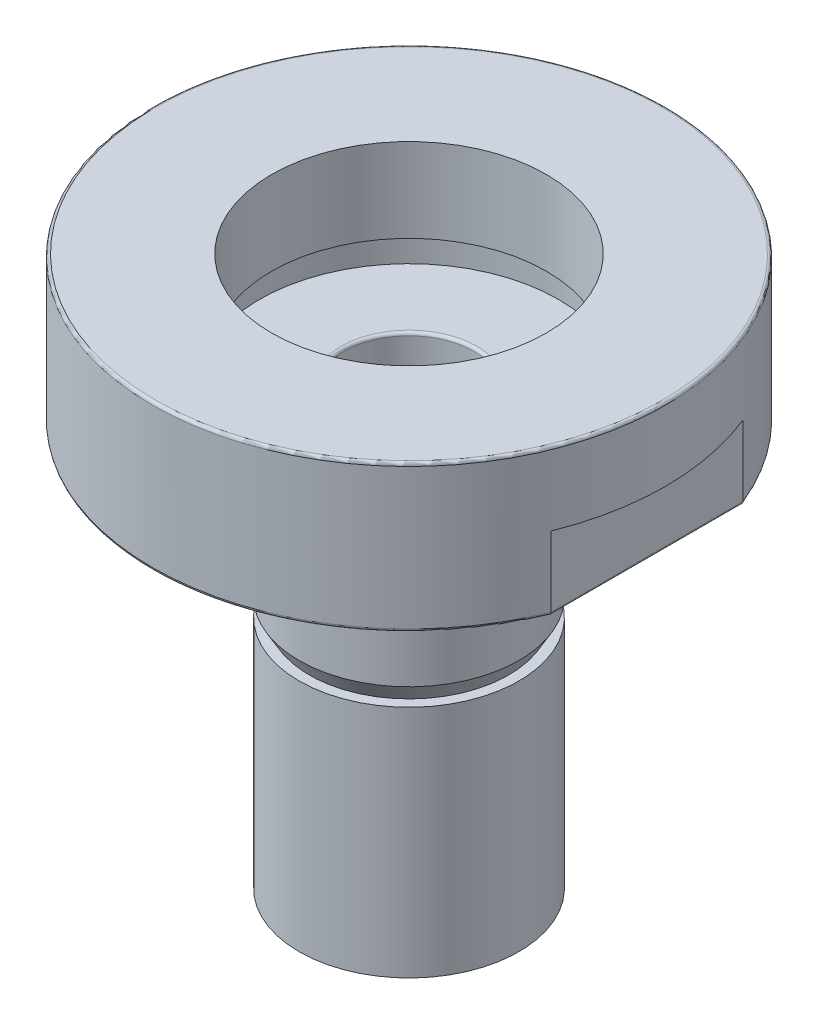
SolidWorks part; units mm, degrees
ref_plane "Front Plane" through (0, 0, 0) normal (0, 0, 1) x (1, 0, 0)
ref_plane "Top Plane" through (0, 0, 0) normal (0, 1, 0) x (1, 0, 0)
ref_plane "Right Plane" through (0, 0, 0) normal (1, 0, 0) x (0, 0, -1)
sketch "Sketch1" plane through (0, 0, 0) normal (1, 0, 0) x (0, 0, -1)
  line L0 (0, 38.646) -> (0, -44.9556) construction
  line L1 (0, 12.7) -> (-22.225, 12.7)
  line L2 (-22.225, 12.7) -> (-22.225, 0)
  line L3 (-22.225, 0) -> (-9.525, 0)
  line L4 (-9.525, 0) -> (-9.525, -34.925)
  line L5 (-9.525, -34.925) -> (0, -34.925)
  line L6 (0, -34.925) -> (0, 12.7)
  dimension "D1" = 19.05
  dimension "D2" = 44.45
  dimension "D3" = 12.7
  dimension "D4" = 34.925
revolve "Revolve1" add sketch "Sketch1" angle 360 about L0
sketch "Sketch2" plane through (0, -34.925, 0) normal (0, -1, 0) x (1, 0, 0)
  circle A0 centre (0, 0) radius 5.6515
  dimension "D1" = 11.303
extrude "Cut-Extrude1" cut sketch "Sketch2" against normal through all
sketch "Sketch6" plane through (0, 12.7, 0) normal (0, 1, 0) x (1, 0, 0)
  circle A0 centre (0, 0) radius 11.9062
  dimension "D1" = 23.8125
extrude "Cut-Extrude3" cut sketch "Sketch6" against normal blind 9.906
sketch "Sketch7" plane through (0, 0, 0) normal (1, 0, 0) x (0, 0, -1)
  line L0 (0, 0) -> (0, 14.7066) construction
  line L1 (-11.9062, 2.794) -> (-12.954, 2.794)
  line L2 (-11.9062, 2.794) -> (-11.9062, 5.4356)
  line L3 (-11.9062, 5.4356) -> (-12.954, 5.4356)
  line L4 (-12.954, 2.794) -> (-12.954, 5.4356)
  line L5 (-22.225, 0) -> (22.225, 0) construction
  dimension "D1" = 2.6416
  dimension "D2" = 25.908
revolve "Cut-Revolve1" cut sketch "Sketch7" angle 360 about L0
sketch "Sketch8" plane through (0, 0, 0) normal (0, 0, 1) x (1, 0, 0)
  line L0 (0, 0) -> (0, -40.6684) construction
  line L1 (-9.525, 0) -> (-8.5509, 0)
  line L2 (-9.525, 0) -> (-9.525, -3.175)
  line L3 (-9.525, -3.175) -> (-8.5509, -3.175)
  line L4 (-8.5509, 0) -> (-8.5509, -3.175)
  dimension "D1" = 17.1018
  dimension "D2" = 3.175
revolve "Cut-Revolve2" cut sketch "Sketch8" angle 360 about L0
sketch "Sketch9" plane through (0, 0, 0) normal (0, -1, 0) x (1, 0, 0)
  line L0 (0, -25.4727) -> (0, 25.4727) construction
  line L1 (-20.6121, 17.5456) -> (-29.1451, 17.5456)
  line L2 (-20.6121, 17.5456) -> (-20.6121, -16.7883)
  line L3 (-20.6121, -16.7883) -> (-29.1451, -16.7883)
  line L4 (-29.1451, 17.5456) -> (-29.1451, -16.7883)
  line L5 (29.1451, 17.5456) -> (29.1451, -16.7883)
  line L6 (20.6121, -16.7883) -> (29.1451, -16.7883)
  line L7 (20.6121, 17.5456) -> (20.6121, -16.7883)
  line L8 (20.6121, 17.5456) -> (29.1451, 17.5456)
  dimension "D1" = 41.2242
extrude "Cut-Extrude4" cut sketch "Sketch9" against normal blind 6.35
sketch "Sketch13" plane through (0, 0, 0) normal (0, 0, 1) x (1, 0, 0)
  line L0 (-20.6121, 0) -> (20.6121, 0) construction
  line L1 (-17.5768, 0) -> (-14.9352, 0)
  line L2 (-17.5768, 0) -> (-17.5768, 1.3208)
  line L3 (-17.5768, 1.3208) -> (-14.9352, 1.3208)
  line L4 (-14.9352, 0) -> (-14.9352, 1.3208)
  line L5 (0, 0) -> (0, 13.1139) construction
  dimension "D1" = 1.3208
  dimension "D2" = 2.6416
  dimension "D3" = 29.8704
revolve "Cut-Revolve10" cut sketch "Sketch13" angle 360 about L5
fillet "Fillet4" radius 0.254 4 edges at (0, 0, -17.5768) (0, 0, -14.9352) (0, 1.3208, -14.9352) (0, 1.3208, -17.5768)
fillet "Fillet5" radius 0.254 10 edges at (0, -34.925, -5.6515) (0, 2.794, 5.6515) (0, -3.175, 9.525) (0, -3.175, 8.5509) (0, 0, 8.5509) (20.6121, 0, 0) (0, 0, -22.225) (0, 0, 22.225) (-20.6121, 0, 0) (0, 12.7, 22.225)
sketch "Sketch14" plane through (0, 12.7, 0) normal (0, 1, 0) x (1, 0, 0)
  circle A0 centre (0, 0) radius 12.7
  dimension "D1" = 25.4
sketch "Sketch15" plane through (0, 0, 0) normal (0, 0, 1) x (1, 0, 0)
  line L0 (-9.525, -13.0696) -> (-8.6385, -14.605)
  line L1 (-9.525, -3.429) -> (-9.525, -34.925) construction
  line L2 (-9.525, -34.925) -> (9.525, -34.925) construction
  line L3 (0, -36.6703) -> (0, -5.3939) construction
  line L4 (-9.525, -13.0696) -> (-11.5892, -13.0696)
  line L5 (-11.5892, -13.0696) -> (-11.5892, -14.605)
  line L6 (-11.5892, -14.605) -> (-8.6385, -14.605)
  dimension "D1" = 20.32
  dimension "D2" = 17.2771
  dimension "D3" = 30
revolve "Cut-Revolve11" cut sketch "Sketch15" angle 360 about L3
